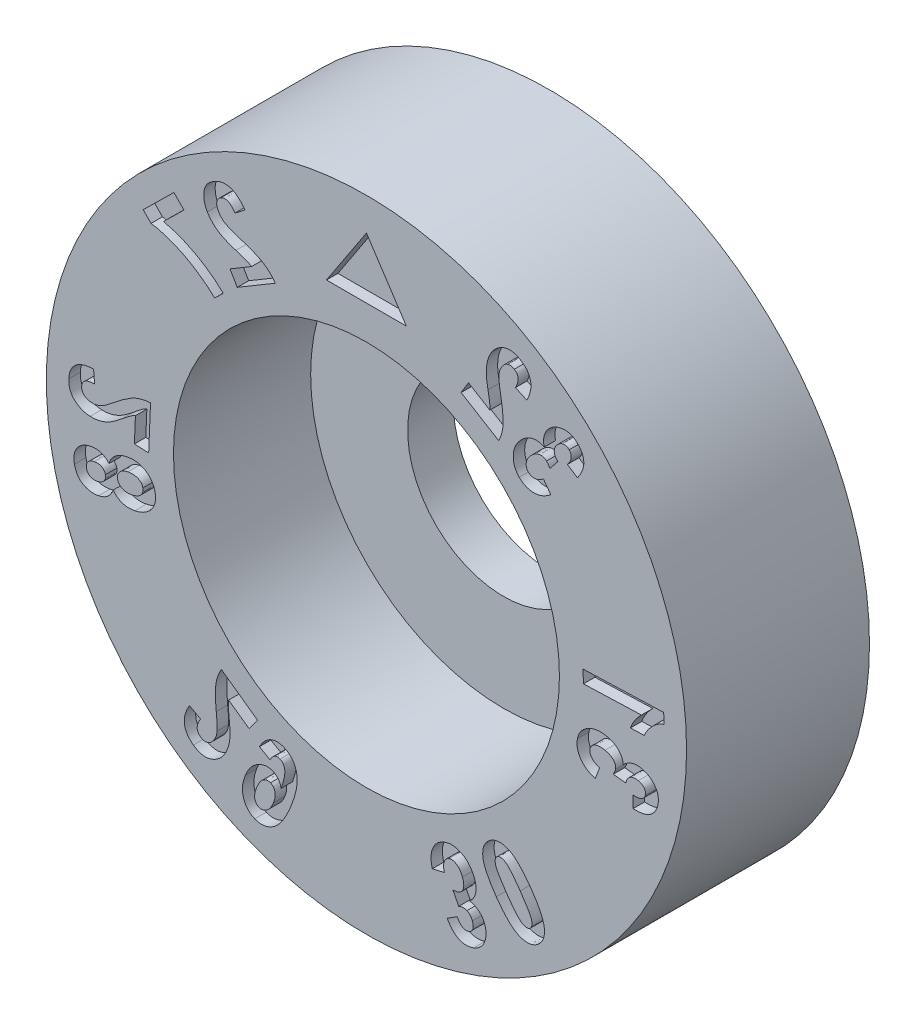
SolidWorks part; units mm, degrees
ref_plane "Front Plane" through (0, 0, 0) normal (0, 0, 1) x (1, 0, 0)
ref_plane "Top Plane" through (0, 0, 0) normal (0, 1, 0) x (1, 0, 0)
ref_plane "Right Plane" through (0, 0, 0) normal (1, 0, 0) x (0, 0, -1)
sketch "Sketch4" plane through (0, 0, 0) normal (0, 0, 1) x (1, 0, 0)
  circle A0 centre (0, 0) radius 7
  dimension "D1" = 14
extrude "Boss-Extrude2" add sketch "Sketch4" against normal blind 4
sketch "Sketch5" plane through (0, 0, 0) normal (0, 0, 1) x (1, 0, 0)
  circle A0 centre (0, 0) radius 4.22
  dimension "D1" = 8.44
extrude "Cut-Extrude2" cut sketch "Sketch5" against normal blind 3
sketch "Sketch6" plane through (0, 0, -3) normal (0, 0, 1) x (1, 0, 0)
  circle A0 centre (0, 0) radius 2.1
  dimension "D1" = 4.2
extrude "Cut-Extrude3" cut sketch "Sketch6" against normal through all
sketch "Sketch1" plane through (0, 0, 0) normal (0, 0, 1) x (1, 0, 0)
  line L6 (0.8741, 4.9578) -> (0, 6.2846)
  line L7 (0, 6.2846) -> (-0.8741, 4.9578)
  line L8 (-0.8741, 4.9578) -> (0.8741, 4.9578)
sketch "Sketch2" plane through (0, 0, 0) normal (0, 0, 1) x (1, 0, 0)
  arc A0 (-1.9477, 4.3647) -> (1.8991, 4.386) centre (0, 0) ccw construction
  text T4 "27    28    29    30    31    32" font "Arial Narrow" height 1.75
  dimension "D1" = 4.7795
extrude "Cut-Extrude1" cut sketch "Sketch2" against normal blind 0.25
extrude "Cut-Extrude4" cut sketch "Sketch1" against normal blind 0.25
sketch "Sketch7" plane through (0, 0, 0) normal (0, 1, 0) x (1, 0, 0)
  line L0 (7, 4) -> (-7, 4) construction
  line L1 (-4.5, 4) -> (-5.5, 4)
  arc A0 (-5.5, 4) -> (-4.5, 4) centre (-5, 4) cw
  dimension "D2" = 0.5
  dimension "D1" = 5
revolve "Revolve1" add sketch "Sketch7" angle 360 about L1
